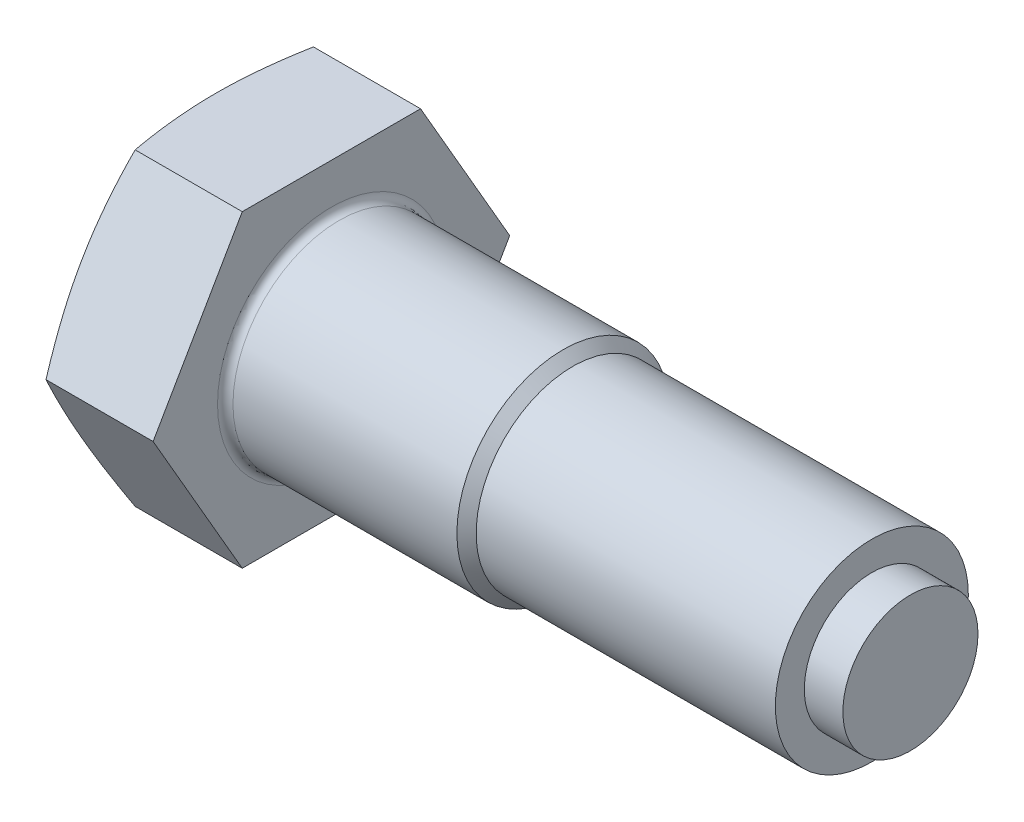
SolidWorks part; units mm, degrees
ref_plane "Front" through (0, 0, 0) normal (0, 0, 1) x (1, 0, 0)
ref_plane "Top" through (0, 0, 0) normal (0, 1, 0) x (1, 0, 0)
ref_plane "Right" through (0, 0, 0) normal (1, 0, 0) x (0, 0, -1)
sketch "Sketch1" plane through (0, 0, 0) normal (1, 0, 0) x (0, 0, -1)
  line L1 (9.2376, 0) -> (4.6188, 8)
  line L2 (4.6188, 8) -> (-4.6188, 8)
  line L3 (-4.6188, 8) -> (-9.2376, 0)
  line L4 (-9.2376, 0) -> (-4.6188, -8)
  line L5 (-4.6188, -8) -> (4.6188, -8)
  line L6 (4.6188, -8) -> (9.2376, 0)
  circle A0 centre (0, 0) radius 8 construction
  dimension "s" = 16
extrude "BaseHead" add sketch "Sketch1" along normal blind 6
sketch "Sketch2" plane through (6, 0, 0) normal (1, 0, 0) x (0, 0, -1)
  circle A0 centre (0, 0) radius 5.5
  dimension "ds" = 11
extrude "Basebody1" add sketch "Sketch2" along normal blind 12
sketch "Sketch4" plane through (18, 0, 0) normal (1, 0, 0) x (0, 0, -1)
  circle A0 centre (0, 0) radius 5
  dimension "d" = 10
extrude "Basebody2" add sketch "Sketch4" along normal offset from surface (18 mm away) 30
sketch "Sketch5" plane through (36, 0, 0) normal (1, 0, 0) x (0, 0, -1)
  circle A0 centre (0, 0) radius 3.5
  dimension "dp" = 7
extrude "Cut-Extrude1" cut sketch "Sketch5" against normal blind 2 flip side to cut
sketch "Sketch6" plane through (0, 0, 0) normal (0, 1, 0) x (1, 0, 0)
  line L0 (0, 9.2376) -> (0.4505, 9.2376)
  line L1 (0.4505, 9.2376) -> (0, 8)
  line L3 (0, 8) -> (0, 9.2376)
  line L4 (-1.5773, 0) -> (3.1205, 0) construction
  line L6 (6, 9.2376) -> (0, 9.2376) construction
  dimension "D1" = 20
  dimension "D2" = 16
revolve "HeadChamfer" cut sketch "Sketch6" angle 360 about L4
fillet "HeadFillet" radius 0.4 1 edges at (6, 0, -5.5)
chamfer "Chamfer1" distance 0.5 angle 45 1 edges at (18, 0, -5)
equation "\"D1@Chamfer1\" =  ( \"ds@Sketch2\" - \"d@Sketch4\" )  / 2"
equation "\"D2@Sketch6\" = \"s@Sketch1\""
